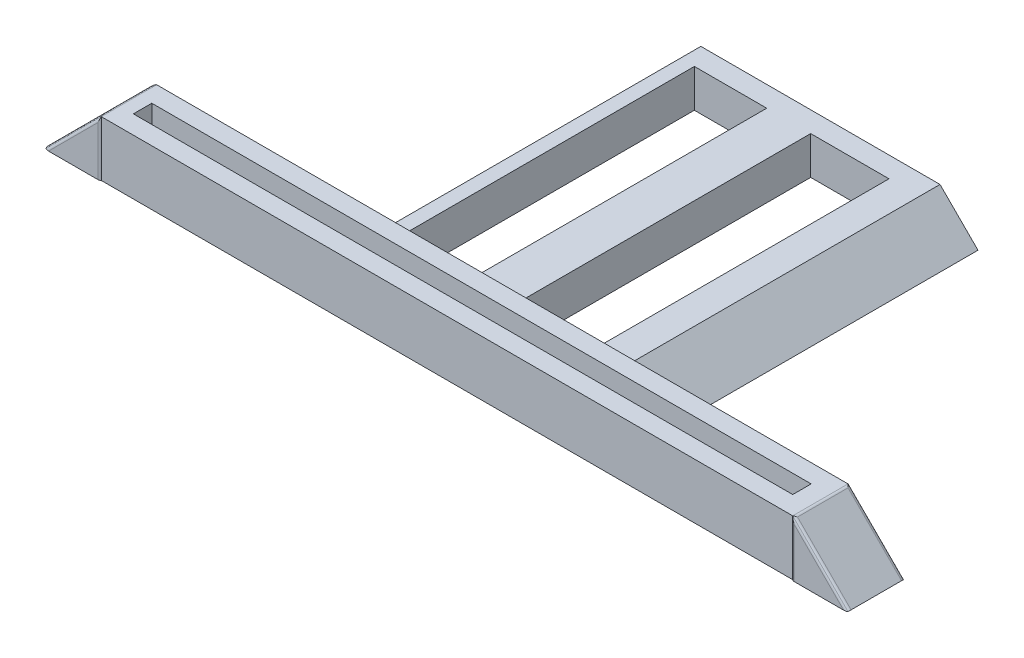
SolidWorks part; units mm, degrees
ref_plane "Front Plane" through (0, 0, 0) normal (0, 0, 1) x (1, 0, 0)
ref_plane "Top Plane" through (0, 0, 0) normal (0, 1, 0) x (1, 0, 0)
ref_plane "Right Plane" through (0, 0, 0) normal (1, 0, 0) x (0, 0, -1)
sketch "Sketch1" plane through (0, 0, 0) normal (1, 0, 0) x (0, 0, -1)
  line L1 (0, 0) -> (152.4, 0)
  line L2 (0, 0) -> (0, 152.4)
  line L3 (0, 152.4) -> (152.4, 152.4)
  line L4 (152.4, 0) -> (152.4, 152.4)
  dimension "D1" = 152.4
  dimension "D2" = 152.4
extrude "Boss-Extrude1" add sketch "Sketch1" against normal blind 1905
sketch "Sketch2" plane through (0, 0, 0) normal (0, 0, 1) x (1, 0, 0)
  line L0 (-1905, 152.4) -> (-2057.4, 0)
  line L1 (-2057.4, 0) -> (-1905, 0)
  line L2 (-1905, 0) -> (-1905, 152.4)
  line L3 (0, 152.4) -> (152.4, 0)
  line L4 (152.4, 0) -> (0, 0)
  line L5 (0, 0) -> (0, 152.4)
extrude "Boss-Extrude2" add sketch "Sketch2" against normal blind 152.4
sketch "Sketch3" plane through (0, 152.4, 0) normal (0, 1, 0) x (1, 0, 0)
  line L0 (-1905, 152.4) -> (0, 152.4) construction
  line L1 (-1867.4982, 50.8) -> (-50.8, 50.8)
  line L2 (-1867.4982, 50.8) -> (-1867.4982, 101.6)
  line L3 (-1867.4982, 101.6) -> (-50.8, 101.6)
  line L4 (-50.8, 50.8) -> (-50.8, 101.6)
  line L5 (0, 152.4) -> (0, 0) construction
  point P6 (-50.8, 76.2)
  dimension "D1" = 50.8
  dimension "D2" = 50.8
  dimension "D3" = 50.8
extrude "Cut-Extrude1" cut sketch "Sketch3" against normal blind 76.2
sketch "Sketch4" plane through (0, 0, -152.4) normal (0, 0, -1) x (-1, 0, 0)
  line L0 (530.9166, 0) -> (635.5589, 104.6423)
  line L1 (2057.4, 0) -> (-152.4, 0) construction
  line L2 (635.5589, 104.6423) -> (1294.5214, 104.6423)
  line L3 (1294.5214, 104.6423) -> (1399.1637, 0)
  line L4 (1399.1637, 0) -> (530.9166, 0)
extrude "Boss-Extrude3" add sketch "Sketch4" along normal blind 889
sketch "Sketch5" plane through (0, 104.6423, 0) normal (0, 1, 0) x (1, 0, 0)
  line L1 (-1255.5713, 192.573) -> (-1056.1758, 192.573)
  line L2 (-1255.5713, 192.573) -> (-1255.5713, 984.5881)
  line L3 (-1255.5713, 984.5881) -> (-1056.1758, 984.5881)
  line L4 (-1056.1758, 192.573) -> (-1056.1758, 984.5881)
  line L5 (-935.1161, 192.573) -> (-719.34, 192.573)
  line L6 (-935.1161, 192.573) -> (-935.1161, 984.5881)
  line L7 (-935.1161, 984.5881) -> (-719.34, 984.5881)
  line L8 (-719.34, 192.573) -> (-719.34, 984.5881)
extrude "Cut-Extrude2" cut sketch "Sketch5" against normal blind 889
sketch "Sketch6" plane through (76.2, 76.2, 0) normal (0.7071, 0.7071, 0) x (0, 0, -1)
  line L1 (0, 107.7631) -> (152.4, 107.7631)
  line L2 (0, 107.7631) -> (0, -107.7631)
  line L3 (0, -107.7631) -> (152.4, -107.7631)
  line L4 (152.4, 107.7631) -> (152.4, -107.7631)
extrude "Boss-Extrude4" add sketch "Sketch6" along normal blind 2.54
sketch "Sketch7" plane through (0, 0, -152.4) normal (0, 0, -1) x (-1, 0, 0)
  line L0 (0, 152.4) -> (0, 0)
  line L1 (0, 0) -> (-152.4, 0)
  line L2 (-152.4, 0) -> (0, 152.4)
extrude "Boss-Extrude5" add sketch "Sketch7" along normal blind 2.54
fillet "Fillet1" radius 10 6 edges at (153.298, 0.898, -152.4) (0.898, 153.298, -152.4) (77.9961, 77.9961, -152.4) (0, 152.4, -153.67) (152.4, 0, -153.67) (76.2, 76.2, -154.94)
sketch "Sketch8" plane through (0, 0, 0) normal (0, 0, 1) x (1, 0, 0)
  line L0 (0, 152.4) -> (0, 0)
  line L1 (0, 0) -> (152.4, 0)
  line L2 (152.4, 0) -> (0, 152.4)
extrude "Boss-Extrude6" add sketch "Sketch8" along normal blind 2.54
fillet "Fillet2" radius 10 6 edges at (0.898, 153.298, 0) (153.298, 0.898, 0) (77.9961, 77.9961, 0) (152.4, 0, 1.27) (0, 152.4, 1.27) (76.2, 76.2, 2.54)
fillet "Fillet3" radius 10 1 edges at (0, 71.4911, 2.54)
fillet "Fillet4" radius 10 1 edges at (1.7961, 154.1961, -76.2)
fillet "Fillet5" radius 10 1 edges at (0, 71.4911, -154.94)
sketch "Sketch9" plane through (-1028.7, 1028.7, 0) normal (-0.7071, 0.7071, 0) x (0, 0, 1)
  line L0 (-152.4, -1239.2753) -> (0, -1239.2753)
  line L1 (0, -1239.2753) -> (0, -1454.8015)
  line L2 (0, -1454.8015) -> (-152.4, -1454.8015)
  line L3 (-152.4, -1454.8015) -> (-152.4, -1239.2753)
extrude "Boss-Extrude7" add sketch "Sketch9" along normal blind 2.54
sketch "Sketch10" plane through (0, 0, 0) normal (0, 0, 1) x (1, 0, 0)
  line L0 (-1905, 152.4) -> (-2057.4, 0)
  line L1 (-1905, 152.4) -> (-1905, 0)
  line L2 (-2057.4, 0) -> (0, 0) construction
  line L3 (-1905, 0) -> (-2057.4, 0)
extrude "Boss-Extrude8" add sketch "Sketch10" along normal blind 2.54
sketch "Sketch11" plane through (0, 0, -152.4) normal (0, 0, -1) x (-1, 0, 0)
  line L0 (1905, 152.4) -> (1905, 0)
  line L1 (2057.4, 0) -> (1399.1637, 0) construction
  line L2 (1905, 0) -> (2057.4, 0)
  line L3 (2057.4, 0) -> (1905, 152.4)
extrude "Boss-Extrude9" add sketch "Sketch11" along normal blind 2.54
fillet "Fillet6" radius 10 4 edges at (-1981.2, 76.2, 2.54) (-1982.9961, 77.9961, 0) (-1982.9961, 77.9961, -152.4) (-1981.2, 76.2, -154.94)
fillet "Fillet7" radius 10 1 edges at (-1906.7961, 154.1961, -76.2)
fillet "Fillet9" radius 10 1 edges at (-1905, 71.4911, -154.94)
fillet "Fillet11" radius 10 1 edges at (-1905, 71.4911, 2.54)
